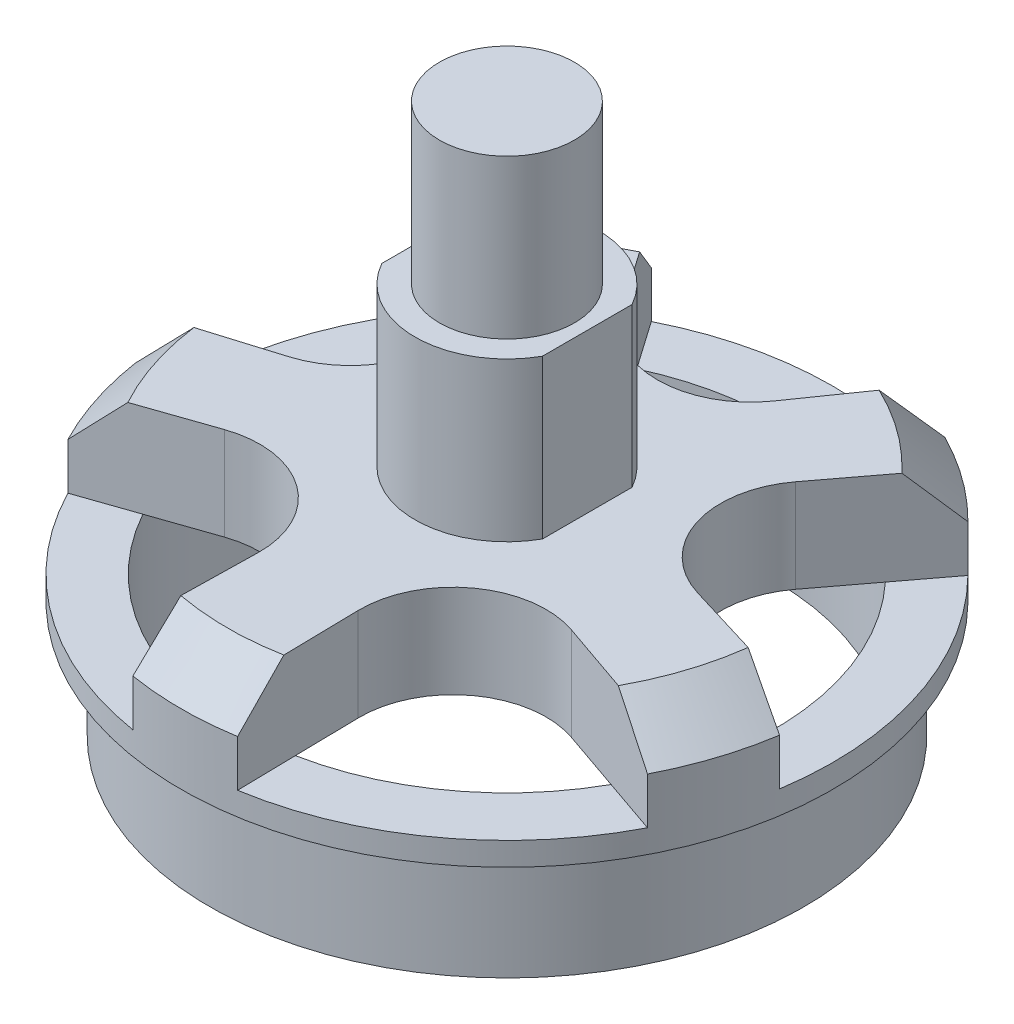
SolidWorks part; units mm, degrees
ref_plane "前视基准面" through (0, 0, 0) normal (0, 0, 1) x (1, 0, 0)
ref_plane "上视基准面" through (0, 0, 0) normal (0, 1, 0) x (1, 0, 0)
ref_plane "右视基准面" through (0, 0, 0) normal (1, 0, 0) x (0, 0, -1)
sketch "草图1" plane through (0, 0, 0) normal (0, 1, 0) x (1, 0, 0)
  circle A0 centre (0, 0) radius 14
  dimension "D1" = 28
extrude "凸台-拉伸1" add sketch "草图1" along normal blind 10
sketch "草图2" plane through (0, 0, 0) normal (0, -1, 0) x (1, 0, 0)
  circle A0 centre (0, 0) radius 11.5
  dimension "D1" = 23
extrude "切除-拉伸1" cut sketch "草图2" against normal blind 6
sketch "草图3" plane through (0, 0, 0) normal (0, -1, 0) x (1, 0, 0)
  circle A0 centre (0, 0) radius 12.75
  circle A1 centre (0, 0) radius 14
  dimension "D1" = 25.5
extrude "切除-拉伸2" cut sketch "草图3" against normal blind 5
sketch "草图4" plane through (0, 10, 0) normal (0, 1, 0) x (1, 0, 0)
  line L0 (-20.0965, 0) -> (19.1891, 0) construction
  line L1 (0, 17.7212) -> (0, 6.4618) construction
  line L2 (-3.28, 8.1724) -> (-6.3017, 12.5015)
  line L3 (6.3017, 12.5015) -> (3.28, 8.1724)
  line L4 (0, 0) -> (0, -18.0948) construction
  line L5 (6.7588, 5.6449) -> (9.9423, 9.8565)
  line L6 (8.786, -0.5941) -> (13.837, -2.1301)
  line L7 (7.4572, -4.6836) -> (12.4464, -6.4099)
  line L8 (2.15, -8.5395) -> (2.25, -13.818)
  line L9 (-2.15, -8.5395) -> (-2.25, -13.818)
  line L10 (-7.4572, -4.6836) -> (-12.4464, -6.4099)
  line L11 (-8.786, -0.5941) -> (-13.837, -2.1301)
  line L12 (-6.7588, 5.6449) -> (-9.9423, 9.8565)
  arc A0 (-3.28, 8.1724) -> (3.28, 8.1724) centre (0, 10.4618) ccw
  circle A1 centre (0, 0) radius 14 construction
  arc A2 (6.3017, 12.5015) -> (-6.3017, 12.5015) centre (0, 0) ccw
  arc A3 (-14, 0) -> (14, 0) centre (0, 0) ccw
  arc A4 (6.7588, 5.6449) -> (8.786, -0.5941) centre (9.9497, 3.2329) ccw
  arc A5 (13.837, -2.1301) -> (9.9423, 9.8565) centre (0, 0) ccw
  arc A6 (7.4572, -4.6836) -> (2.15, -8.5395) centre (6.1493, -8.4638) ccw
  arc A7 (2.25, -13.818) -> (12.4464, -6.4099) centre (0, 0) ccw
  arc A8 (-2.15, -8.5395) -> (-7.4572, -4.6836) centre (-6.1493, -8.4638) ccw
  arc A9 (-12.4464, -6.4099) -> (-2.25, -13.818) centre (0, 0) ccw
  arc A10 (-8.786, -0.5941) -> (-6.7588, 5.6449) centre (-9.9497, 3.2329) ccw
  arc A11 (-9.9423, 9.8565) -> (-13.837, -2.1301) centre (0, 0) ccw
  point P38 (0, 0)
  dimension "D1" = 8
  dimension "D2" = 4.3
  dimension "D4" = 4.5
  dimension "D3" = 5
chamfer "倒角1" distance 2 angle 45 1 edges at (0, 10, 14)
sketch "草图5" plane through (0, 10, 0) normal (0, 1, 0) x (1, 0, 0)
  line L0 (-3.45, 1.9235) -> (-3.45, -1.9235)
  line L1 (0, 6.6936) -> (0, -8.1105) construction
  line L2 (3.45, 1.9235) -> (3.45, -1.9235)
  arc A0 (-3.45, -1.9235) -> (3.45, -1.9235) centre (0, 0) ccw
  arc A1 (3.45, 1.9235) -> (-3.45, 1.9235) centre (0, 0) ccw
  dimension "D1" = 7.9
  dimension "D2" = 6.9
extrude "凸台-拉伸2" add sketch "草图5" along normal blind 6.8
sketch "草图6" plane through (0, 16.8, 0) normal (0, 1, 0) x (1, 0, 0)
  circle A0 centre (0, 0) radius 2.9
  dimension "D1" = 5.8
extrude "凸台-拉伸3" add sketch "草图6" along normal blind 6.8
sketch "草图7" plane through (0, 6, 0) normal (0, -1, 0) x (1, 0, 0)
  circle A0 centre (0, 0) radius 1.5
  dimension "D1" = 3
extrude "切除-拉伸4" cut sketch "草图7" against normal blind 5
extrude "切除-拉伸5" cut sketch "草图4" against normal blind 4 contours L5 A4 L6 M1 | L2 A0 L3 M1 | L11 A10 L12 M1 | L9 A8 L10 M1 | L7 A6 L8 M1
